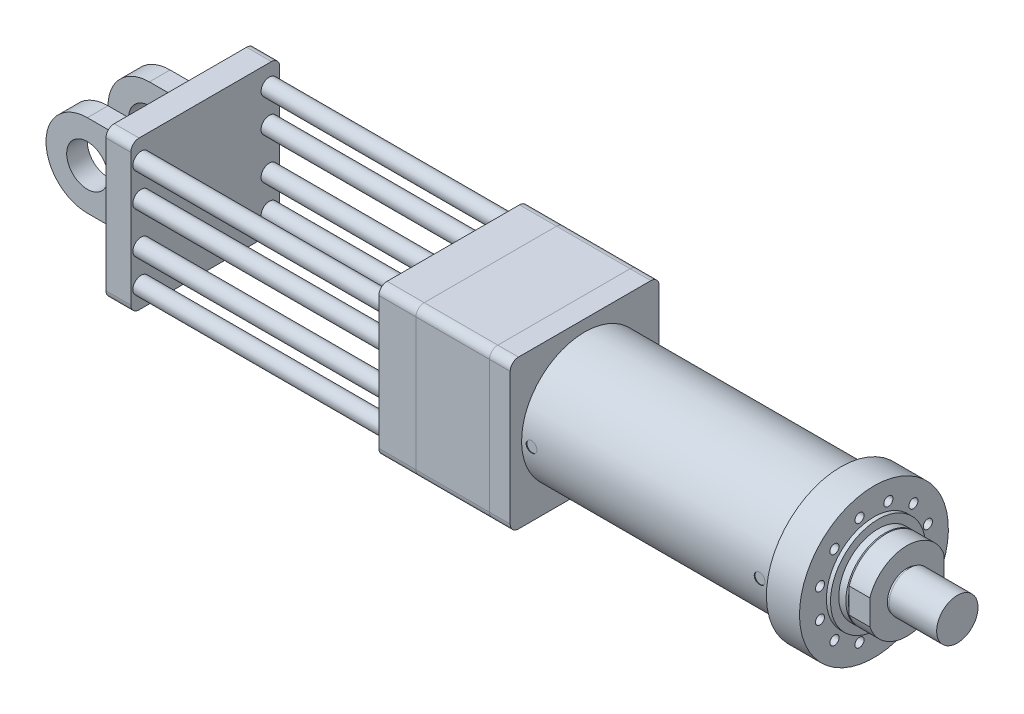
SolidWorks part; units mm, degrees
ref_plane "前视基准面" through (0, 0, 0) normal (0, 0, 1) x (1, 0, 0)
ref_plane "上视基准面" through (0, 0, 0) normal (0, 1, 0) x (1, 0, 0)
ref_plane "右视基准面" through (0, 0, 0) normal (1, 0, 0) x (0, 0, -1)
sketch "草图2" plane through (0, 0, 0) normal (0, 0, 1) x (1, 0, 0)
  line L0 (0, 0) -> (0, 152.5)
  line L1 (0, 152.5) -> (619.5, 152.5)
  line L6 (619.5, 152.5) -> (619.5, 0)
  line L7 (619.5, 0) -> (0, 0)
  dimension "D1" = 152.5
  dimension "D4" = 619.5
revolve "旋转1" add sketch "草图2" angle 360 about L7
sketch "草图3" plane through (619.5, 0, 0) normal (1, 0, 0) x (0, 0, -1)
  line L0 (0, 0) -> (232.7364, 0) construction
  line L1 (0, 0) -> (226.3775, 60.6577) construction
  circle A0 centre (0, 0) radius 180
  circle A1 centre (0, 0) radius 135 construction
  circle A2 centre (130.4, 34.9406) radius 11
  circle A3 centre (130.4, -34.9406) radius 11
  circle A4 centre (95.4594, -95.4594) radius 11
  circle A5 centre (34.9406, -130.4) radius 11
  circle A6 centre (-34.9406, -130.4) radius 11
  circle A7 centre (-95.4594, -95.4594) radius 11
  circle A8 centre (-130.4, -34.9406) radius 11
  circle A9 centre (-130.4, 34.9406) radius 11
  circle A10 centre (-95.4594, 95.4594) radius 11
  circle A11 centre (-34.9406, 130.4) radius 11
  circle A12 centre (34.9406, 130.4) radius 11
  circle A13 centre (95.4594, 95.4594) radius 11
  point P32 (0, 0)
  dimension "D1" = 360
  dimension "D2" = 270
  dimension "D4" = 22
  dimension "D3" = 15
  dimension "D5" = 12
extrude "凸台-拉伸1" add sketch "草图3" along normal blind 80
sketch "草图4" plane through (699.5, 0, 0) normal (1, 0, 0) x (0, 0, -1)
  circle A0 centre (0, 0) radius 115
  dimension "D1" = 230
extrude "凸台-拉伸2" add sketch "草图4" along normal blind 10
sketch "草图5" plane through (709.5, 0, 0) normal (1, 0, 0) x (0, 0, -1)
  circle A0 centre (0, 0) radius 95
  dimension "D1" = 190
extrude "凸台-拉伸3" add sketch "草图5" along normal blind 20
chamfer "倒角1" distance 3 angle 45 1 edges at (729.5, 95, 0)
ref_plane "基准面1" through (0, 0, 152.5) normal (0, 0, 1) x (1, 0, 0)
ref_plane "基准面2" through (0, 0, -152.5) normal (0, 0, 1) x (1, 0, 0)
sketch "草图17" plane through (0, 0, -152.5) normal (0, 0, 1) x (1, 0, 0)
  circle A0 centre (44, 0) radius 13
  dimension "D1" = 26
  dimension "D2" = 44
extrude "切除-拉伸6" cut sketch "草图17" along normal blind 2
sketch "草图19" plane through (0, 0, 152.5) normal (0, 0, 1) x (1, 0, 0)
  line L0 (619.5, 180) -> (619.5, -180) construction
  circle A0 centre (24, 0) radius 13
  circle A1 centre (575.5, 0) radius 13
  dimension "D1" = 24
  dimension "D2" = 26
  dimension "D3" = 26
  dimension "D4" = 44
extrude "切除-拉伸7" cut sketch "草图19" against normal blind 2
sketch "草图23" plane through (0, 0, 0) normal (-1, 0, 0) x (0, 0, 1)
  line L1 (-180, 180) -> (180, 180)
  line L2 (-180, 180) -> (-180, -180)
  line L3 (-180, -180) -> (180, -180)
  line L4 (180, 180) -> (180, -180)
  line L5 (-180, 180) -> (180, -180) construction
  line L6 (-180, -180) -> (180, 180) construction
  circle A0 centre (0, 0) radius 180 construction
  dimension "D1" = 360
  dimension "D2" = 360
  dimension "D3" = 360
extrude "凸台-拉伸8" add sketch "草图23" along normal blind 50
sketch "草图24" plane through (729.5, 0, 0) normal (1, 0, 0) x (0, 0, -1)
  line L2 (-90, 30.4138) -> (-90, -30.4138)
  line L4 (90, 30.4138) -> (90, -30.4138)
  line L5 (-58.2393, 75.0546) -> (58.2393, -75.0546) construction
  line L6 (-58.2393, -75.0546) -> (58.2393, 75.0546) construction
  arc A0 (-90, -30.4138) -> (90, -30.4138) centre (0, 0) ccw
  arc A1 (90, 30.4138) -> (-90, 30.4138) centre (0, 0) ccw
  dimension "D1" = 190
extrude "凸台-拉伸9" add sketch "草图24" along normal blind 50
sketch "草图25" plane through (779.5, 0, 0) normal (1, 0, 0) x (0, 0, -1)
  circle A0 centre (0, 0) radius 47.5
  dimension "D1" = 95
extrude "凸台-拉伸10" add sketch "草图25" along normal blind 5
sketch "草图26" plane through (784.5, 0, 0) normal (1, 0, 0) x (0, 0, -1)
  circle A0 centre (1.644, 0) radius 50
  dimension "D1" = 100
extrude "凸台-拉伸11" add sketch "草图26" along normal blind 115
sketch "草图28" plane through (-50, 0, 0) normal (-1, 0, 0) x (0, 0, 1)
  line L1 (-180, 180) -> (180, 180)
  line L2 (-180, 180) -> (-180, -180)
  line L3 (-180, -180) -> (180, -180)
  line L4 (180, 180) -> (180, -180)
  line L5 (-180, 180) -> (180, -180) construction
  line L6 (-180, -180) -> (180, 180) construction
  point P0 (0, 0)
extrude "凸台-拉伸12" add sketch "草图28" along normal blind 178 separate body
sketch "草图29" plane through (-228, 0, 0) normal (-1, 0, 0) x (0, 0, 1)
  line L1 (-180, 180) -> (180, 180)
  line L2 (-180, 180) -> (-180, -180)
  line L3 (-180, -180) -> (180, -180)
  line L4 (180, 180) -> (180, -180)
  line L5 (-180, 180) -> (180, -180) construction
  line L6 (-180, -180) -> (180, 180) construction
  point P0 (0, 0)
extrude "凸台-拉伸13" add sketch "草图29" along normal blind 89.5 separate body
fillet "圆角1" radius 20 4 edges at (-25, -180, -180) (-25, 180, -180) (-25, -180, 180) (-25, 180, 180)
fillet "圆角2" radius 20 4 edges at (-139, -180, 180) (-139, 180, 180) (-139, -180, -180) (-139, 180, -180)
fillet "圆角3" radius 20 4 edges at (-272.75, -180, 180) (-272.75, 180, 180) (-272.75, -180, -180) (-272.75, 180, -180)
sketch "草图30" plane through (-317.5, 0, 0) normal (-1, 0, 0) x (0, 0, 1)
  line L0 (-180, 160) -> (-180, -160) construction
  line L1 (-160, -180) -> (160, -180) construction
  line L2 (160, 180) -> (-160, 180) construction
  line L3 (0, 180) -> (0, 0) construction
  circle A0 centre (-155, 130) radius 20
  circle A1 centre (-155, 50) radius 20
  circle A2 centre (-155, -50) radius 20
  circle A3 centre (-155, -130) radius 20
  circle A4 centre (155, -130) radius 20
  circle A5 centre (155, -50) radius 20
  circle A6 centre (155, 50) radius 20
  circle A7 centre (155, 130) radius 20
  dimension "D1" = 40
  dimension "D2" = 40
  dimension "D3" = 40
  dimension "D4" = 40
  dimension "D5" = 25
  dimension "D6" = 50
  dimension "D7" = 50
  dimension "D8" = 80
  dimension "D9" = 80
extrude "凸台-拉伸14" add sketch "草图30" along normal blind 600
sketch "草图31" plane through (-917.5, 0, 0) normal (-1, 0, 0) x (0, 0, 1)
  line L0 (0, 180) -> (0, 0) construction
  line L1 (-180, 180) -> (180, 180)
  line L2 (-180, 180) -> (-180, -180)
  line L3 (-180, -180) -> (180, -180)
  line L4 (180, 180) -> (180, -180)
  line L5 (-180, 180) -> (180, -180) construction
  line L6 (-180, -180) -> (180, 180) construction
  point P0 (0, 0)
  dimension "D1" = 360
  dimension "D2" = 360
extrude "凸台-拉伸15" add sketch "草图31" along normal blind 60
fillet "圆角4" radius 20 4 edges at (-947.5, -180, -180) (-947.5, -180, 180) (-947.5, 180, -180) (-947.5, 180, 180)
sketch "草图32" plane through (-977.5, 0, 0) normal (-1, 0, 0) x (0, 0, 1)
  line L0 (-75, 0) -> (75, 0) construction
  line L2 (-100, 100) -> (-50, 100)
  line L3 (-100, 100) -> (-100, -100)
  line L4 (-100, -100) -> (-50, -100)
  line L5 (-50, 100) -> (-50, -100)
  line L6 (-100, 100) -> (-50, -100) construction
  line L7 (-100, -100) -> (-50, 100) construction
  line L8 (50, 100) -> (100, 100)
  line L9 (50, 100) -> (50, -100)
  line L10 (50, -100) -> (100, -100)
  line L11 (100, 100) -> (100, -100)
  line L12 (50, 100) -> (100, -100) construction
  line L13 (50, -100) -> (100, 100) construction
  point P4 (0, 0)
  dimension "D1" = 200
  dimension "D2" = 100
  dimension "D3" = 50
  dimension "D4" = 200
  dimension "D5" = 200
extrude "凸台-拉伸16" add sketch "草图32" along normal blind 225
sketch "草图33" plane through (0, 0, 100) normal (0, 0, 1) x (1, 0, 0)
  line L0 (-1202.5, 0) -> (-1102.5, 0) construction
  line L1 (-1202.5, -100) -> (-1202.5, 100) construction
  line L2 (-1102.5, 100) -> (-1310.0573, 175.4369)
  line L3 (-1310.0573, 175.4369) -> (-1310.0573, -219.0265)
  line L4 (-1310.0573, -219.0265) -> (-1102.5, -100)
  arc A0 (-1102.5, 100) -> (-1102.5, -100) centre (-1102.5, 0) ccw
  circle A1 centre (-1102.5, 0) radius 50
  dimension "D2" = 100
  dimension "D1" = 100
extrude "切除-拉伸8" cut sketch "草图33" against normal blind 225
